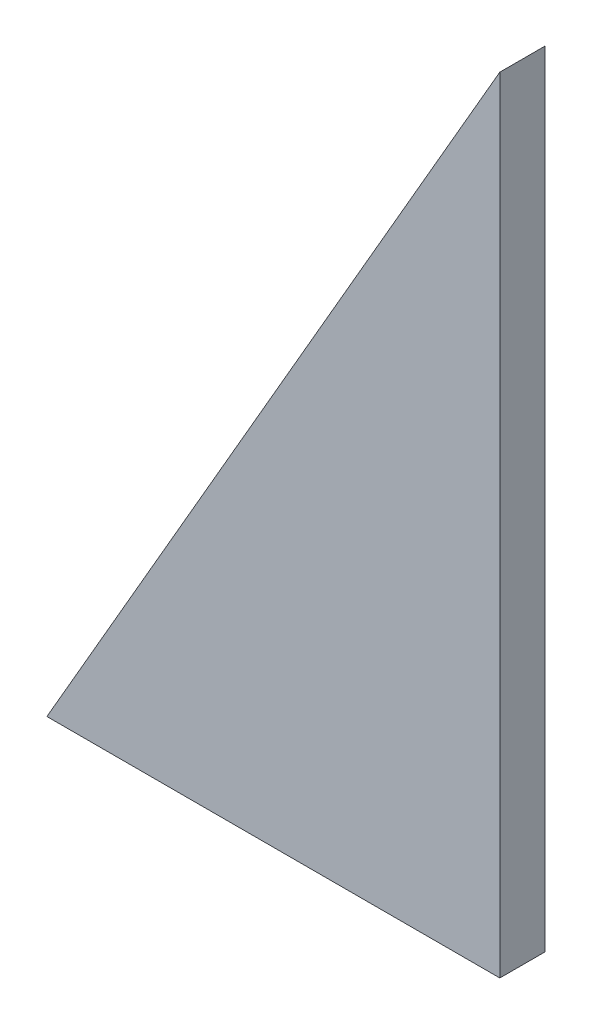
SolidWorks part; units mm, degrees
ref_plane "Przednia" through (0, 0, 0) normal (0, 0, 1) x (1, 0, 0)
ref_plane "Górna" through (0, 0, 0) normal (0, 1, 0) x (1, 0, 0)
ref_plane "Prawa" through (0, 0, 0) normal (1, 0, 0) x (0, 0, -1)
sketch "Szkic1" plane through (0, 0, 0) normal (0, 0, 1) x (1, 0, 0)
  line L0 (0, 0) -> (80, 0)
  line L1 (80, 0) -> (80, 138.5641)
  line L2 (80, 138.5641) -> (0, 0)
  dimension "D1" = 80
  dimension "D2" = 60
extrude "Dodanie-wyciągnięcie1" add sketch "Szkic1" along normal blind 8
hole_wizard "Otwór gwintowany M5x0.81" positions "Szkic3" profile "Szkic2" tap size "M5x0.8" standard "Ansi Metric"
sketch "Szkic3" plane through (0, 0, 0) normal (-0.866, 0.5, 0) x (0, 0, 1)
  line L0 (4, 0) -> (4, 35)
  line L1 (8, 0) -> (0, 0) construction
  line L2 (4, 35) -> (4, 110)
  point P0 (4, 35)
  point P2 (4, 110)
  dimension "D1" = 35
  dimension "D2" = 110
sketch "Szkic2" plane through (17.5, 30.3109, 4) normal (0, 0, 1) x (-0.5, -0.866, 0)
  line L0 (0, 0) -> (0, 15.2618)
  line L1 (0, 15.2618) -> (2.1, 14)
  line L2 (2.1, 14) -> (2.1, 0)
  line L5 (2.1, 0) -> (0, 0)
  line L10 (0, 15.2618) -> (-2.1, 14) construction
  line L11 (0, -6.35) -> (0, 107.95) construction
  dimension "Średnica wiertła gwintu" = 4.2
  dimension "Głębokość otworu gwintowanego" = 14
  dimension "Kąt wiertła" = 118
hole_wizard "Otwór gwintowany M5x0.82" positions "Szkic5" profile "Szkic4" tap size "M5x0.8" standard "Ansi Metric"
sketch "Szkic5" plane through (0, 0, 0) normal (0, -1, 0) x (-1, 0, 0)
  line L0 (0, -4) -> (-23.5, -4)
  line L1 (0, -8) -> (0, 0) construction
  line L2 (-23.5, -4) -> (-53.5, -4)
  point P0 (-23.5, -4)
  point P2 (-53.5, -4)
  dimension "D1" = 30
  dimension "D2" = 23.5
sketch "Szkic4" plane through (23.5, 0, 4) normal (1, 0, 0) x (0, 0, -1)
  line L0 (0, 0) -> (0, 15.2618)
  line L1 (0, 15.2618) -> (2.1, 14)
  line L2 (2.1, 14) -> (2.1, 0)
  line L5 (2.1, 0) -> (0, 0)
  line L10 (0, 15.2618) -> (-2.1, 14) construction
  line L11 (0, -6.35) -> (0, 107.95) construction
  dimension "Średnica wiertła gwintu" = 4.2
  dimension "Głębokość otworu gwintowanego" = 14
  dimension "Kąt wiertła" = 118
